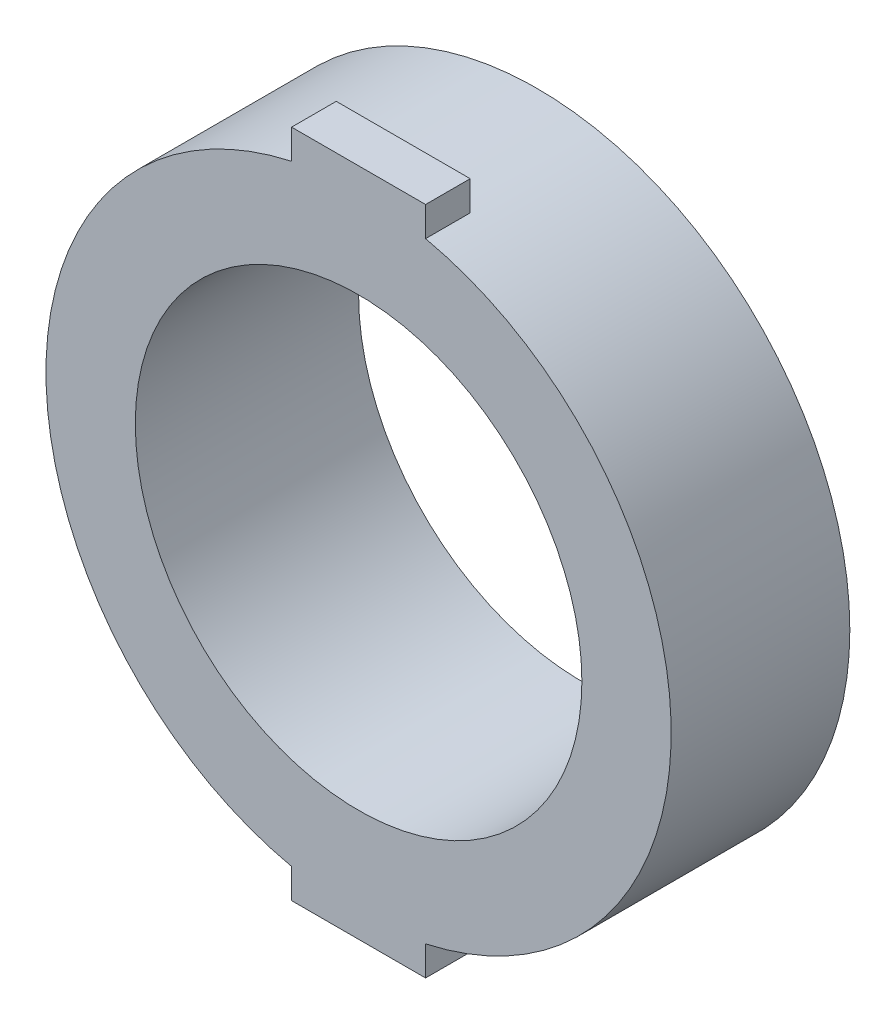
SolidWorks part; units mm, degrees
ref_plane "Plan1" through (0, 0, 0) normal (0, 0, 1) x (1, 0, 0)
ref_plane "Plan2" through (0, 0, 0) normal (0, 1, 0) x (1, 0, 0)
ref_plane "Plan3" through (0, 0, 0) normal (1, 0, 0) x (0, 0, -1)
sketch "Esquisse1" plane through (0, 0, 0) normal (0, 0, 1) x (1, 0, 0)
  circle A0 centre (0, 0) radius 7
  circle A1 centre (0, 0) radius 5
  dimension "D1" = 14
  dimension "D2" = 10
extrude "Base-Extrusion" add sketch "Esquisse1" along normal blind 4
sketch "Esquisse2" plane through (0, 0, 4) normal (0, 0, 1) x (1, 0, 0)
  line L0 (-1.5, 7.5) -> (-1.5, 6.1453)
  line L1 (-1.5, 7.5) -> (1.5, 7.5)
  line L2 (-1.5, 6.1453) -> (1.5, 6.1453)
  line L3 (-1.5, -7.5) -> (1.5, -7.5)
  line L4 (1.5, 6.1453) -> (1.5, 7.5)
  line L5 (-1.5, -7.5) -> (-1.5, -6.0751)
  line L6 (-1.5, -6.0751) -> (1.5, -6.0751)
  line L7 (1.5, -6.0751) -> (1.5, -7.5)
  dimension "D1" = 15
  dimension "D2" = 7.5
  dimension "D3" = 3
  dimension "D4" = 1.5
extrude "Boss.-Extru.1" add sketch "Esquisse2" against normal blind 1
sketch "Esquisse3" plane through (0, 0, 0) normal (0, 0, -1) x (-1, 0, 0)
  circle A0 centre (0, 0) radius 5.5
  circle A1 centre (0, 0) radius 5
  dimension "D1" = 11
extrude "Boss.-Extru.2" add sketch "Esquisse3" along normal blind 1
